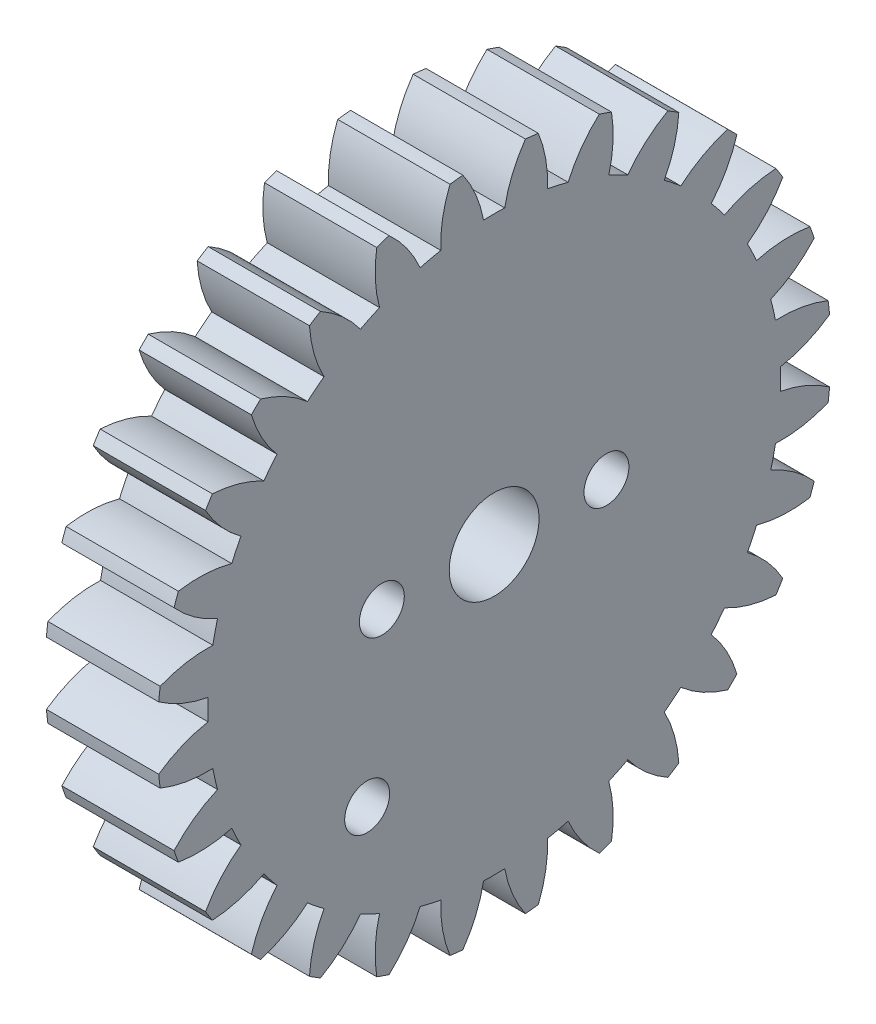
SolidWorks part; units mm, degrees
ref_plane "Front Plane" through (0, 0, 0) normal (0, 0, 1) x (1, 0, 0)
ref_plane "Top Plane" through (0, 0, 0) normal (0, 1, 0) x (1, 0, 0)
ref_plane "Right Plane" through (0, 0, 0) normal (1, 0, 0) x (0, 0, -1)
inserted part "spur gear_am<7>@tmpAssm"
sketch "Sketch1" plane through (-5.7393, 0, 0) normal (1, 0, 0) x (0, 0, -1)
  line L0 (2.8465, -56.4382) -> (14.6267, -56.4382) construction
  line L1 (2.8465, -56.4382) -> (-2.7177, -63.608) construction
  circle A0 centre (-2.8078, -63.7242) radius 1
  circle A1 centre (7.8465, -56.4382) radius 1
  circle A2 centre (-2.1535, -56.4382) radius 1
  circle A3 centre (2.8465, -56.4382) radius 2 construction
  dimension "D2" = 5
  dimension "D3" = 5
  dimension "D4" = 9.2227
  dimension "D1" = 232.186
extrude "Cut-Extrude1" cut sketch "Sketch1" against normal blind 10
sketch "Sketch2" plane through (-5.7393, 0, 0) normal (1, 0, 0) x (0, 0, -1)
  line L0 (2.8465, -56.4382) -> (15.3796, -56.4382)
